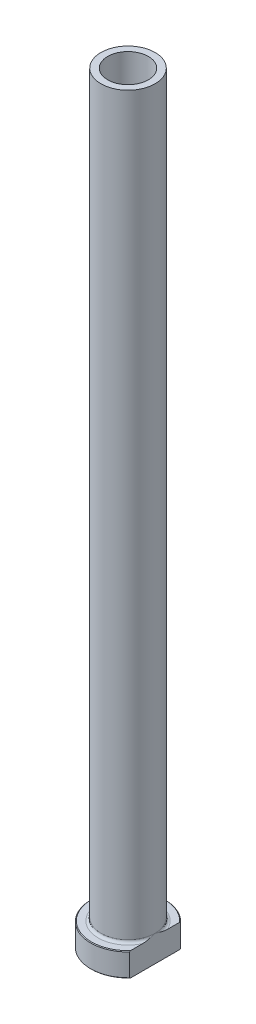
SolidWorks part; units mm, degrees
ref_plane "Front Plane" through (0, 0, 0) normal (0, 0, 1) x (1, 0, 0)
ref_plane "Top Plane" through (0, 0, 0) normal (0, 1, 0) x (1, 0, 0)
ref_plane "Right Plane" through (0, 0, 0) normal (1, 0, 0) x (0, 0, -1)
sketch "Sketch1" plane through (0, 0, 0) normal (0, 0, 1) x (1, 0, 0)
  line L0 (-6, 225) -> (-8, 225)
  line L1 (-8, 225) -> (-8, 7)
  line L2 (-8, 7) -> (-11, 7)
  line L3 (-11, 7) -> (-11, 0)
  line L4 (10.45, 0) -> (-10.45, 0) construction
  line L5 (-11, 0) -> (-6.25, 0)
  line L6 (-6, 170) -> (-6, 225)
  line L7 (0, 92.1877) -> (0, -15.5353) construction
  line L8 (0, -12.1) -> (0, 12.1) construction
  line L9 (-6, 170) -> (-6.25, 158)
  line L10 (-6.25, 158) -> (-6.25, 0)
  dimension "D1" = 0.25
  dimension "ID" = 12
  dimension "OD" = 16
  dimension "L" = 225
  dimension "H" = 22
  dimension "T" = 7
  dimension "N" = 55
  dimension "D2" = 12
  dimension "L-N" = 170
revolve "Revolve1" add sketch "Sketch1" angle 360 about L7
fillet "Fillet1" radius 0.8 1 edges at (0, 7, 8)
chamfer "Chamfer1" distance 0.2 angle 45 2 edges at (0, 7, 11) (0, 0, 11)
sketch "Sketch2" plane through (0, 0, 0) normal (0, -1, 0) x (1, 0, 0)
  line L0 (8, 7.5498) -> (8, -7.5498)
  circle A0 centre (0, 0) radius 11 construction
  arc A1 (8, 7.5498) -> (8, -7.5498) centre (0, 0) cw
  circle A2 centre (0, 0) radius 8 construction
extrude "Cut-Extrude1" cut sketch "Sketch2" against normal through all
chamfer "Chamfer2" distance 0.5 angle 45 1 edges at (0, 0, 6.25)
